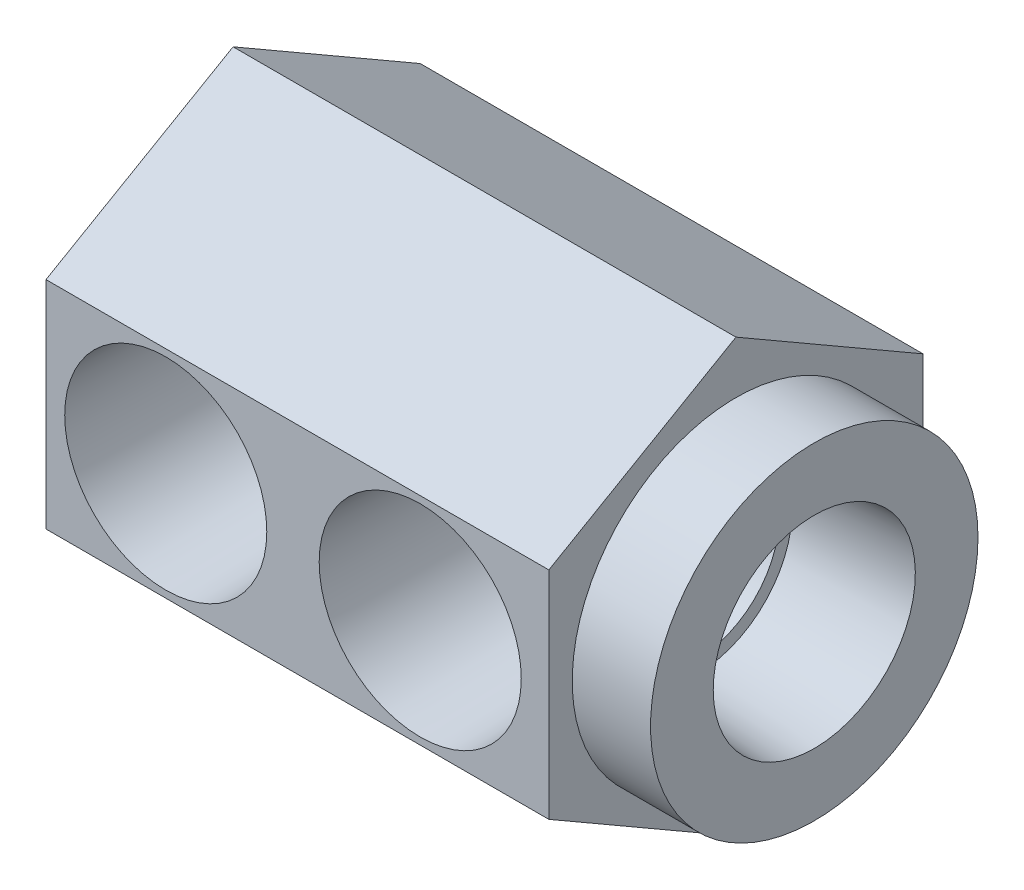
SolidWorks part; units mm, degrees
ref_plane "Front Plane" through (0, 0, 0) normal (0, 0, 1) x (1, 0, 0)
ref_plane "Top Plane" through (0, 0, 0) normal (0, 1, 0) x (1, 0, 0)
ref_plane "Right Plane" through (0, 0, 0) normal (1, 0, 0) x (0, 0, -1)
sketch "Sketch2" plane through (0, 0, 0) normal (1, 0, 0) x (0, 0, -1)
  line L0 (0, 16.1312) -> (0, -16.1312) construction
  line L1 (-12.7, -7.3323) -> (0, -14.6647)
  line L2 (0, -14.6647) -> (12.7, -7.3323)
  line L3 (12.7, -7.3323) -> (12.7, 7.3323)
  line L4 (12.7, 7.3323) -> (0, 14.6647)
  line L5 (0, 14.6647) -> (-12.7, 7.3323)
  line L6 (-12.7, 7.3323) -> (-12.7, -7.3323)
  circle A0 centre (0, 0) radius 12.7 construction
  dimension "D1" = 25.4
extrude "Boss-Extrude1" add sketch "Sketch2" along normal blind 34.1313 separate body
sketch "Sketch3" plane through (34.1313, 0, 0) normal (1, 0, 0) x (0, 0, -1)
  circle A1 centre (0, 0) radius 11.1125
  dimension "D1" = 22.225
extrude "Boss-Extrude2" add sketch "Sketch3" along normal blind 5.3162
sketch "Sketch4" plane through (0, 0, 0) normal (0, 1, 0) x (1, 0, 0)
  line L1 (39.4475, 6.8593) -> (31.51, 6.4433)
  line L3 (31.51, 5.5562) -> (31.51, 6.4433)
  line L5 (39.4475, 0) -> (39.4475, 6.8593)
  line L6 (-12.2162, 0) -> (49987.7838, 0) construction
  line L7 (26.7475, 5.5562) -> (31.51, 5.5562)
  line L8 (26.7475, 5.5562) -> (26.7475, 0)
  line L9 (26.7475, 0) -> (39.4475, 0)
  line L10 (39.4475, -11.1125) -> (39.4475, 11.1125) construction
  dimension "D1" = 11.1125
  dimension "D2" = 3
  dimension "D3" = 7.9375
  dimension "D4" = 12.7
  dimension "D5" = 13.7185
revolve "Cut-Revolve1" cut sketch "Sketch4" angle 360 about L6
hole_wizard "1/4 NPT Tapped Hole1" positions "Sketch6" profile "Sketch5" size "1/4" standard "Ansi Inch"
sketch "Sketch6" plane through (0, 0, -12.7) normal (0, 0, -1) x (-1, 0, 0)
  line L0 (13.97, 0) -> (-13.97, 0) construction
  line L1 (0, 13.97) -> (0, -13.97) construction
  point P0 (-8.128, 0)
  dimension "D1" = 8.128
sketch "Sketch5" plane through (8.128, 0, -12.7) normal (1, 0, 0) x (0, 1, 0)
  line L0 (0, 0) -> (0, 20.4111)
  line L1 (5.5626, 17.0688) -> (0, 20.4111)
  line L2 (-5.5626, 17.0688) -> (0, 20.4111) construction
  line L3 (5.5626, 17.0688) -> (5.5626, 10.0203)
  line L4 (5.5626, 10.0203) -> (6.558, 10.0203)
  line L5 (6.558, 10.0203) -> (6.858, 0)
  line L6 (-6.558, 10.0203) -> (-6.858, 0) construction
  line L7 (6.858, 0) -> (0, 0)
  line L8 (0, -6.35) -> (0, 107.95) construction
  line L11 (-5.5626, 10.0203) -> (-6.558, 10.0203) construction
  dimension "Tap Drill Dia." = 11.1252
  dimension "Tap Drill Depth" = 17.0688
  dimension "Thread Dia." = 13.716
  dimension "Thread Angle" = 3.43
  dimension "Thread Depth" = 10.0203
  dimension "Drill Angle" = 118
hole_wizard "1/4 NPT Tapped Hole2" positions "Sketch8" profile "Sketch7" size "1/4" standard "Ansi Inch"
sketch "Sketch8" plane through (0, 0, 12.7) normal (0, 0, 1) x (1, 0, 0)
  line L0 (0, -13.97) -> (0, 13.97) construction
  circle A0 centre (8.128, 0) radius 6.858 construction
  point P0 (8.128, 0)
  point P1 (25.4, 0)
  dimension "D1" = 25.4
sketch "Sketch7" plane through (8.128, 0, 12.7) normal (1, 0, 0) x (0, -1, 0)
  line L0 (0, 0) -> (0, 20.4111)
  line L1 (5.5626, 17.0688) -> (0, 20.4111)
  line L2 (-5.5626, 17.0688) -> (0, 20.4111) construction
  line L3 (5.5626, 17.0688) -> (5.5626, 10.0203)
  line L4 (5.5626, 10.0203) -> (6.558, 10.0203)
  line L5 (6.558, 10.0203) -> (6.858, 0)
  line L6 (-6.558, 10.0203) -> (-6.858, 0) construction
  line L7 (6.858, 0) -> (0, 0)
  line L8 (0, -6.35) -> (0, 107.95) construction
  line L11 (-5.5626, 10.0203) -> (-6.558, 10.0203) construction
  dimension "Tap Drill Dia." = 11.1252
  dimension "Tap Drill Depth" = 17.0688
  dimension "Thread Dia." = 13.716
  dimension "Thread Angle" = 3.43
  dimension "Thread Depth" = 10.0203
  dimension "Drill Angle" = 118
hole_wizard "5/16-24 Tapped Hole1" positions "Sketch12" profile "Sketch11" tap size "5/16-24" standard "ANSI Inch"
sketch "Sketch12" plane through (39.4475, 0, 0) normal (1, 0, 0) x (0, 0, -1)
  circle A0 centre (0, 0) radius 6.8593 construction
  point P0 (0, 0)
sketch "Sketch11" plane through (39.4475, 0, 0) normal (0, 1, 0) x (0, 0, -1)
  line L0 (0, 0) -> (0, 30.6532)
  line L1 (0, 30.6532) -> (3.4544, 28.5775)
  line L2 (3.4544, 28.5775) -> (3.4544, 27.178)
  line L3 (3.4544, 27.178) -> (3.9687, 27.178)
  line L4 (3.9687, 27.178) -> (3.9688, 0)
  line L5 (3.9688, 0) -> (0, 0)
  line L10 (0, 30.6532) -> (-3.4544, 28.5775) construction
  line L11 (0, -6.35) -> (0, 107.95) construction
  dimension "Tap Drill Dia." = 6.9088
  dimension "Tap Drill Depth" = 28.5775
  dimension "Thread Major Dia." = 7.9375
  dimension "Thread Depth" = 27.178
  dimension "Drill Angle" = 118
